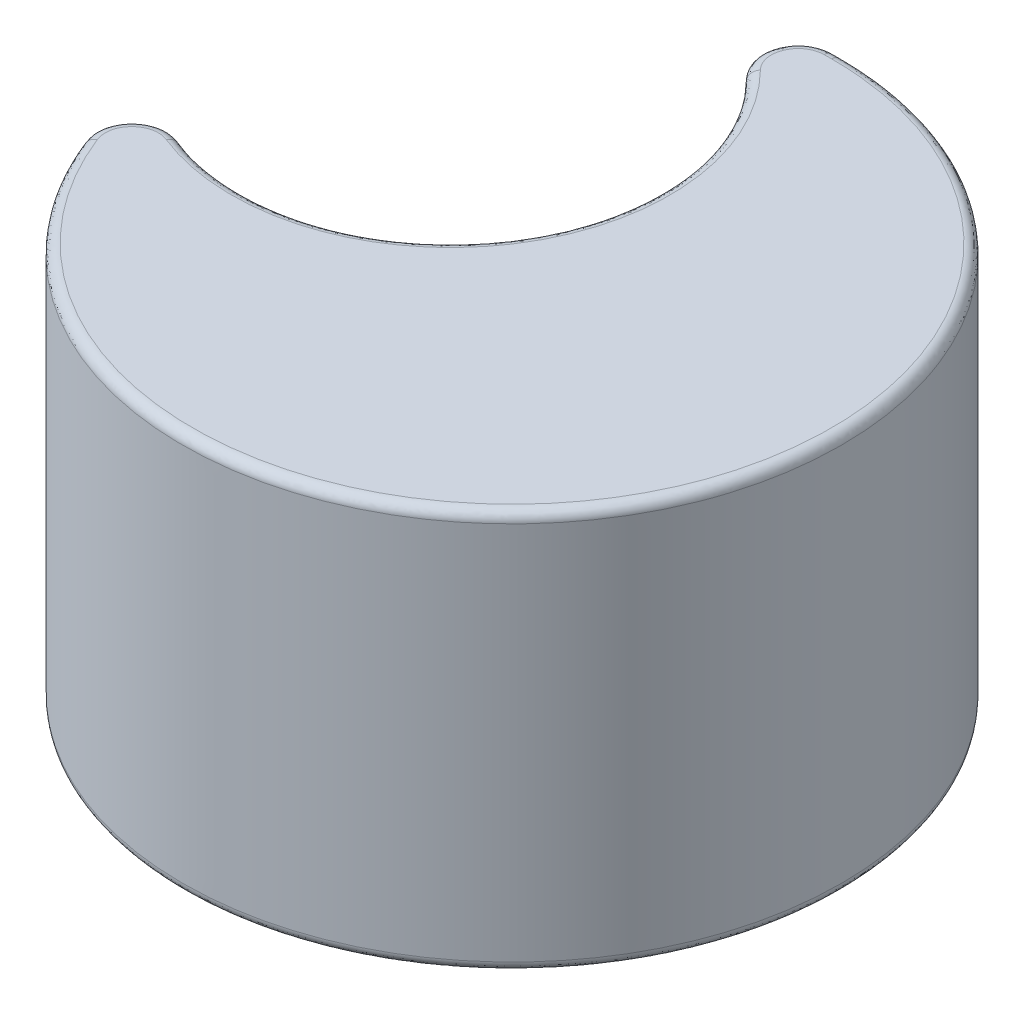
SolidWorks part; units mm, degrees
ref_plane "Front Plane" through (0, 0, 0) normal (0, 0, 1) x (1, 0, 0)
ref_plane "Top Plane" through (0, 0, 0) normal (0, 1, 0) x (1, 0, 0)
ref_plane "Right Plane" through (0, 0, 0) normal (1, 0, 0) x (0, 0, -1)
body saved out of another part "Stock-Wooden Clock Video-1"
fillet "Fillet1" radius 0.5 12 edges
